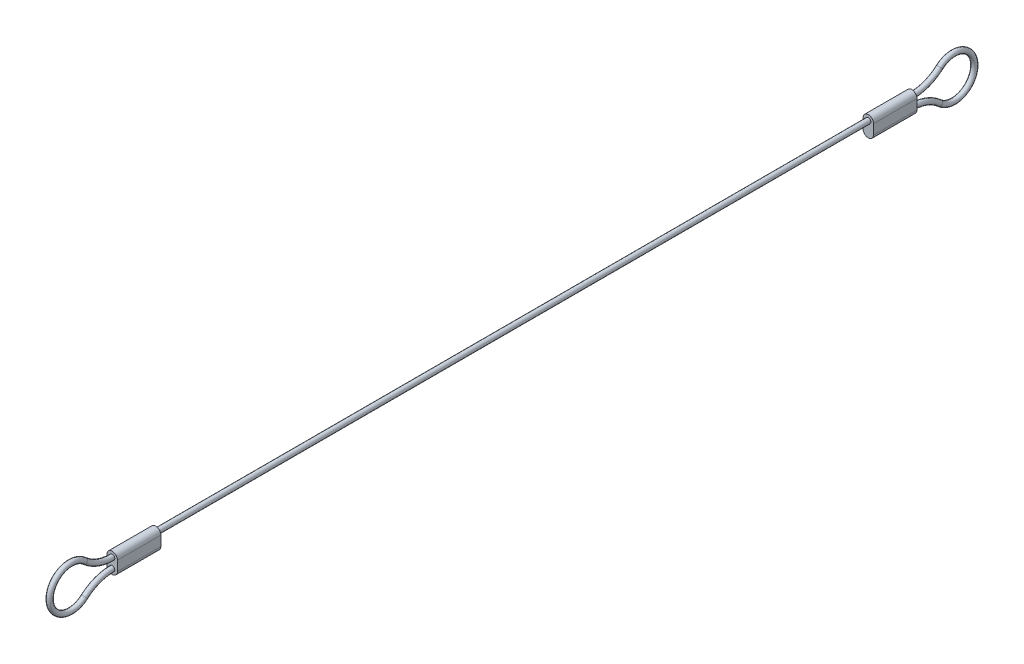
SolidWorks part; units mm, degrees
ref_plane "Front Plane" through (0, 0, 0) normal (0, 0, 1) x (1, 0, 0)
ref_plane "Top Plane" through (0, 0, 0) normal (0, 1, 0) x (1, 0, 0)
ref_plane "Right Plane" through (0, 0, 0) normal (1, 0, 0) x (0, 0, -1)
sketch "Sketch1" plane through (0, 0, 0) normal (1, 0, 0) x (0, 0, -1)
  line L0 (92, 0) -> (-92, 0)
  line L1 (0, 1.32) -> (0, -1.32) construction
  arc A0 (-92, 0) -> (-98.4, 2.4446) centre (-92, 9.6) cw
  arc A1 (-98.4, 2.4446) -> (-98.4, -4.7108) centre (-101.6, -1.1331) ccw
  arc A2 (-98.4, -4.7108) -> (-92, -2.2663) centre (-92, -11.8663) cw
  arc A3 (98.4, -4.7108) -> (92, -2.2663) centre (92, -11.8663) ccw
  arc A4 (98.4, 2.4446) -> (98.4, -4.7108) centre (101.6, -1.1331) cw
  arc A5 (92, 0) -> (98.4, 2.4446) centre (92, 9.6) ccw
  point P18 (0, 0)
  dimension "D1" = 4.8
  dimension "D4" = 9.6
  dimension "D2" = 101.6
  dimension "D3" = 9.6
sketch "Sketch2" plane through (0, 0, 0) normal (0, 0, 1) x (1, 0, 0)
  circle A0 centre (0, 0) radius 0.595
  dimension "D1" = 1.19
sweep "Sweep1" add profiles "Sketch2" path "Sketch1"
sketch "Sketch3" plane through (0, 0, 92) normal (0, 0, -1) x (-1, 0, 0)
  line L0 (0, 0) -> (0, -2.2663) construction
  line L1 (1.2, 0) -> (1.2, -2.2663)
  line L2 (-1.2, 0) -> (-1.2, -2.2663)
  line L3 (-0.595, -2.2663) -> (0.595, -2.2663) construction
  arc A0 (1.2, 0) -> (-1.2, 0) centre (0, 0) ccw
  arc A1 (-1.2, -2.2663) -> (1.2, -2.2663) centre (0, -2.2663) ccw
  point P3 (0, -1.1331)
  dimension "D1" = 2.4
extrude "Boss-Extrude1" add sketch "Sketch3" along normal blind 10
mirror "Mirror1" about plane through (0, 0, 0) normal (0, 0, 1) of "Boss-Extrude1"
